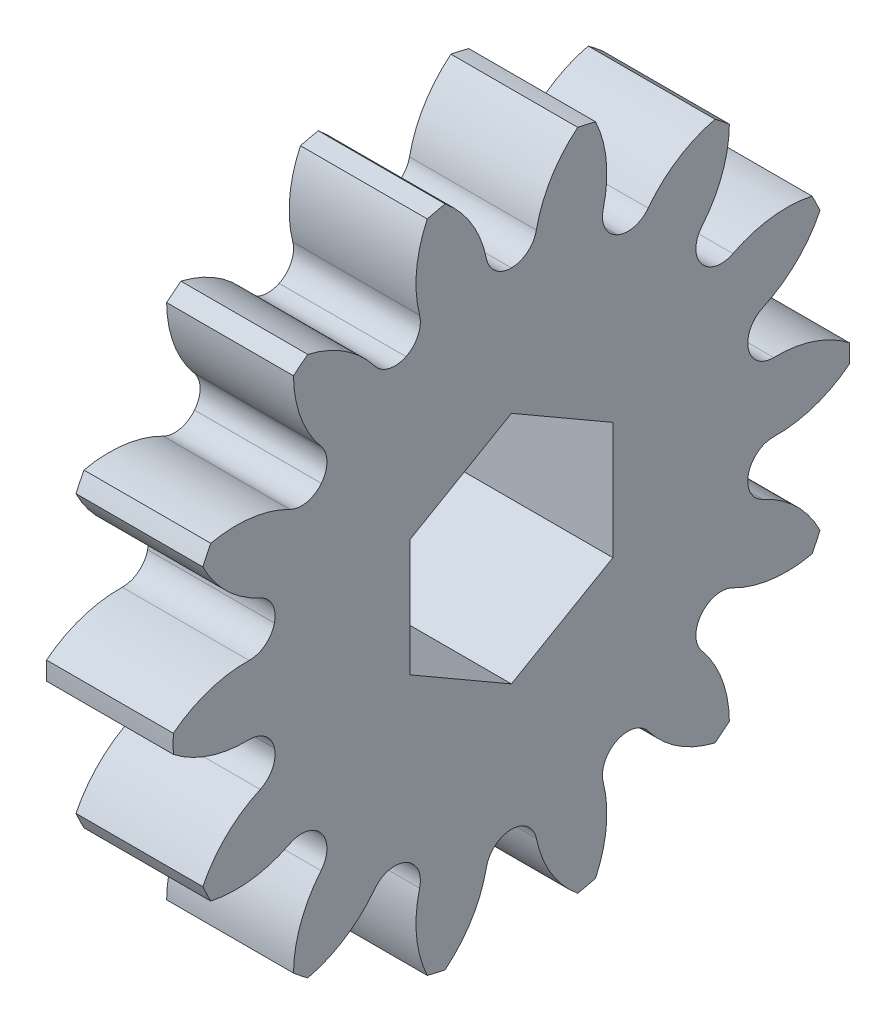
SolidWorks part; units mm, degrees
ref_plane "Front Plane" through (0, 0, 0) normal (0, 0, 1) x (1, 0, 0)
ref_plane "Top Plane" through (0, 0, 0) normal (0, 1, 0) x (1, 0, 0)
ref_plane "Right Plane" through (0, 0, 0) normal (1, 0, 0) x (0, 0, -1)
ref_plane "Plane1" through (0, 0, 0) normal (0, 0, -1) x (-1, 0, 0)
sketch "Sketch1" plane through (0, 0, 0) normal (0, 0, -1) x (-1, 0, 0)
  line L0 (-15, 40) -> (-15, 0)
  line L1 (-15, 0) -> (0, 0)
  line L2 (0, 0) -> (0, 40)
  line L3 (0, 40) -> (-15, 40)
  line L4 (-15, 0) -> (0, 0) construction
  dimension "D1" = 40
  dimension "D2" = 15
revolve "Revolve1" add sketch "Sketch1" angle 360 about L4
sketch "Sketch2" plane through (15, 0, 0) normal (1, 0, 0) x (0, 0, -1)
  arc A0 (35.5563, 18.3234) -> (25.7761, 30.5875) centre (0, 0) ccw
  arc A1 (25.7761, 30.5875) -> (20.7157, 19.934) centre (11.7766, 30.7085) cw
  arc A2 (20.7157, 19.934) -> (24.0439, 15.7606) centre (0, 0) cw
  arc A3 (24.0439, 15.7606) -> (35.5563, 18.3234) centre (32.5591, 4.648) cw
extrude "Cut-Extrude1" cut sketch "Sketch2" against normal through all
sketch "Sketch3" plane through (15, 0, 0) normal (1, 0, 0) x (0, 0, -1)
  arc A0 (39.9854, 1.0815) -> (36.4948, 16.3746) centre (0, 0) ccw
  arc A1 (36.4948, 16.3746) -> (27.3133, 8.9717) centre (23.9343, 22.5578) cw
  arc A2 (27.3133, 8.9717) -> (28.5011, 3.7676) centre (0, 0) cw
  arc A3 (28.5011, 3.7676) -> (39.9854, 1.0815) centre (31.3515, -9.9392) cw
extrude "Cut-Extrude2" cut sketch "Sketch3" against normal through all
sketch "Sketch4" plane through (15, 0, 0) normal (1, 0, 0) x (0, 0, -1)
  arc A0 (36.4948, -16.3746) -> (39.9854, -1.0815) centre (0, 0) ccw
  arc A1 (39.9854, -1.0815) -> (28.5011, -3.7676) centre (31.3515, 9.9392) cw
  arc A2 (28.5011, -3.7676) -> (27.3133, -8.9717) centre (0, 0) cw
  arc A3 (27.3133, -8.9717) -> (36.4948, -16.3746) centre (23.9343, -22.5578) cw
extrude "Cut-Extrude3" cut sketch "Sketch4" against normal through all
sketch "Sketch5" plane through (15, 0, 0) normal (1, 0, 0) x (0, 0, -1)
  arc A0 (25.7761, -30.5875) -> (35.5563, -18.3234) centre (0, 0) ccw
  arc A1 (35.5563, -18.3234) -> (24.0439, -15.7606) centre (32.5591, -4.648) cw
  arc A2 (24.0439, -15.7606) -> (20.7157, -19.934) centre (0, 0) cw
  arc A3 (20.7157, -19.934) -> (25.7761, -30.5875) centre (11.7766, -30.7085) cw
extrude "Cut-Extrude4" cut sketch "Sketch5" against normal through all
sketch "Sketch6" plane through (15, 0, 0) normal (1, 0, 0) x (0, 0, -1)
  arc A0 (9.952, -38.7422) -> (24.0849, -31.9362) centre (0, 0) ccw
  arc A1 (24.0849, -31.9362) -> (14.8245, -24.6321) centre (27.3181, -18.3146) cw
  arc A2 (14.8245, -24.6321) -> (10.0152, -26.9481) centre (0, 0) cw
  arc A3 (10.0152, -26.9481) -> (9.952, -38.7422) centre (-2.7136, -32.7771) cw
extrude "Cut-Extrude5" cut sketch "Sketch6" against normal through all
sketch "Sketch7" plane through (15, 0, 0) normal (1, 0, 0) x (0, 0, -1)
  arc A0 (-7.8432, -39.2235) -> (7.8432, -39.2235) centre (0, 0) ccw
  arc A1 (7.8432, -39.2235) -> (2.669, -28.6248) centre (16.6663, -28.3538) cw
  arc A2 (2.669, -28.6248) -> (-2.669, -28.6248) centre (0, 0) cw
  arc A3 (-2.669, -28.6248) -> (-7.8432, -39.2235) centre (-16.6663, -28.3538) cw
extrude "Cut-Extrude6" cut sketch "Sketch7" against normal through all
sketch "Sketch8" plane through (15, 0, 0) normal (1, 0, 0) x (0, 0, -1)
  arc A0 (-24.0849, -31.9362) -> (-9.952, -38.7422) centre (0, 0) ccw
  arc A1 (-9.952, -38.7422) -> (-10.0152, -26.9481) centre (2.7136, -32.7771) cw
  arc A2 (-10.0152, -26.9481) -> (-14.8245, -24.6321) centre (0, 0) cw
  arc A3 (-14.8245, -24.6321) -> (-24.0849, -31.9362) centre (-27.3181, -18.3146) cw
extrude "Cut-Extrude7" cut sketch "Sketch8" against normal through all
sketch "Sketch9" plane through (15, 0, 0) normal (1, 0, 0) x (0, 0, -1)
  arc A0 (-35.5563, -18.3234) -> (-25.7761, -30.5875) centre (0, 0) ccw
  arc A1 (-25.7761, -30.5875) -> (-20.7157, -19.934) centre (-11.7766, -30.7085) cw
  arc A2 (-20.7157, -19.934) -> (-24.0439, -15.7606) centre (0, 0) cw
  arc A3 (-24.0439, -15.7606) -> (-35.5563, -18.3234) centre (-32.5591, -4.648) cw
extrude "Cut-Extrude8" cut sketch "Sketch9" against normal through all
sketch "Sketch10" plane through (15, 0, 0) normal (1, 0, 0) x (0, 0, -1)
  arc A0 (-39.9854, -1.0815) -> (-36.4948, -16.3746) centre (0, 0) ccw
  arc A1 (-36.4948, -16.3746) -> (-27.3133, -8.9717) centre (-23.9343, -22.5578) cw
  arc A2 (-27.3133, -8.9717) -> (-28.5011, -3.7676) centre (0, 0) cw
  arc A3 (-28.5011, -3.7676) -> (-39.9854, -1.0815) centre (-31.3515, 9.9392) cw
extrude "Cut-Extrude9" cut sketch "Sketch10" against normal through all
sketch "Sketch11" plane through (15, 0, 0) normal (1, 0, 0) x (0, 0, -1)
  arc A0 (-36.4948, 16.3746) -> (-39.9854, 1.0815) centre (0, 0) ccw
  arc A1 (-39.9854, 1.0815) -> (-28.5011, 3.7676) centre (-31.3515, -9.9392) cw
  arc A2 (-28.5011, 3.7676) -> (-27.3133, 8.9717) centre (0, 0) cw
  arc A3 (-27.3133, 8.9717) -> (-36.4948, 16.3746) centre (-23.9343, 22.5578) cw
extrude "Cut-Extrude10" cut sketch "Sketch11" against normal through all
sketch "Sketch12" plane through (15, 0, 0) normal (1, 0, 0) x (0, 0, -1)
  arc A0 (-25.7761, 30.5875) -> (-35.5563, 18.3234) centre (0, 0) ccw
  arc A1 (-35.5563, 18.3234) -> (-24.0439, 15.7606) centre (-32.5591, 4.648) cw
  arc A2 (-24.0439, 15.7606) -> (-20.7157, 19.934) centre (0, 0) cw
  arc A3 (-20.7157, 19.934) -> (-25.7761, 30.5875) centre (-11.7766, 30.7085) cw
extrude "Cut-Extrude11" cut sketch "Sketch12" against normal through all
sketch "Sketch13" plane through (15, 0, 0) normal (1, 0, 0) x (0, 0, -1)
  arc A0 (-9.952, 38.7422) -> (-24.0849, 31.9362) centre (0, 0) ccw
  arc A1 (-24.0849, 31.9362) -> (-14.8245, 24.6321) centre (-27.3181, 18.3146) cw
  arc A2 (-14.8245, 24.6321) -> (-10.0152, 26.9481) centre (0, 0) cw
  arc A3 (-10.0152, 26.9481) -> (-9.952, 38.7422) centre (2.7136, 32.7771) cw
extrude "Cut-Extrude12" cut sketch "Sketch13" against normal through all
sketch "Sketch14" plane through (15, 0, 0) normal (1, 0, 0) x (0, 0, -1)
  arc A0 (7.8432, 39.2235) -> (-7.8432, 39.2235) centre (0, 0) ccw
  arc A1 (-7.8432, 39.2235) -> (-2.669, 28.6248) centre (-16.6663, 28.3538) cw
  arc A2 (-2.669, 28.6248) -> (2.669, 28.6248) centre (0, 0) cw
  arc A3 (2.669, 28.6248) -> (7.8432, 39.2235) centre (16.6663, 28.3538) cw
extrude "Cut-Extrude13" cut sketch "Sketch14" against normal through all
sketch "Sketch15" plane through (15, 0, 0) normal (1, 0, 0) x (0, 0, -1)
  arc A0 (24.0849, 31.9362) -> (9.952, 38.7422) centre (0, 0) ccw
  arc A1 (9.952, 38.7422) -> (10.0152, 26.9481) centre (-2.7136, 32.7771) cw
  arc A2 (10.0152, 26.9481) -> (14.8245, 24.6321) centre (0, 0) cw
  arc A3 (14.8245, 24.6321) -> (24.0849, 31.9362) centre (27.3181, 18.3146) cw
extrude "Cut-Extrude14" cut sketch "Sketch15" against normal through all
sketch "Sketch16" plane through (0, 0, 0) normal (-1, 0, 0) x (0, 0, 1)
  circle A0 centre (0, 0) radius 19.5
  dimension "D1" = 39
extrude "Boss-Extrude1" add sketch "Sketch16" along normal blind 4
sketch "Sketch17" plane through (15, 0, 0) normal (1, 0, 0) x (0, 0, -1)
  line L1 (0, 13.8564) -> (-12, 6.9282)
  line L2 (-12, 6.9282) -> (-12, -6.9282)
  line L3 (-12, -6.9282) -> (0, -13.8564)
  line L4 (0, -13.8564) -> (12, -6.9282)
  line L5 (12, -6.9282) -> (12, 6.9282)
  line L6 (12, 6.9282) -> (0, 13.8564)
  circle A0 centre (0, 0) radius 12 construction
  dimension "D1" = 24
fillet "Fillet1" radius 3 28 edges at (7.5, -15.7606, 24.0439) (7.5, 26.9481, 10.0152) (7.5, 8.9717, 27.3133) (7.5, 15.7606, -24.0439) (7.5, 24.6321, -14.8245) (7.5, 8.9717, -27.3133) (7.5, -3.7676, 28.5011) (7.5, 3.7676, -28.5011) (7.5, 19.934, 20.7157) (7.5, -3.7676, -28.5011) (7.5, 28.6248, -2.669) (7.5, -8.9717, -27.3133) (7.5, -19.934, 20.7157) (7.5, -15.7606, -24.0439) (7.5, -8.9717, 27.3133) (7.5, -19.934, -20.7157) (7.5, 3.7676, 28.5011) (7.5, -24.6321, -14.8245) (7.5, 15.7606, 24.0439) (7.5, -26.9481, -10.0152) (7.5, 24.6321, 14.8245) (7.5, -28.6248, -2.669) (7.5, 28.6248, 2.669) (7.5, -28.6248, 2.669) (7.5, 26.9481, -10.0152) (7.5, -26.9481, 10.0152) (7.5, 19.934, -20.7157) (7.5, -24.6321, 14.8245)
extrude "Cut-Extrude16" cut sketch "Sketch17" against normal through all
